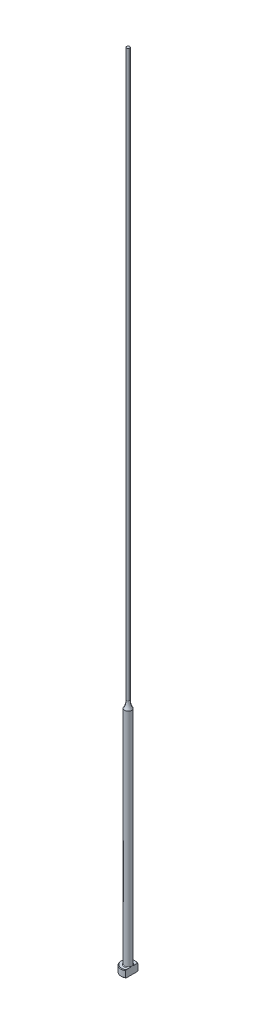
SolidWorks part; units mm, degrees
ref_plane "Front Plane" through (0, 0, 0) normal (0, 0, 1) x (1, 0, 0)
ref_plane "Top Plane" through (0, 0, 0) normal (0, 1, 0) x (1, 0, 0)
ref_plane "Right Plane" through (0, 0, 0) normal (1, 0, 0) x (0, 0, -1)
sketch "Sketch1" plane through (0, 0, 0) normal (0, 0, 1) x (1, 0, 0)
  line L0 (0, 259.9588) -> (0, -15.1925) construction
  line L1 (0, 0) -> (-3.175, 0)
  line L2 (-3.175, 0) -> (-3.175, 3.175)
  line L3 (-3.175, 3.175) -> (-1.5875, 3.175)
  line L4 (-0.6579, 104.9079) -> (-0.6579, 355.6)
  line L5 (-0.6579, 355.6) -> (0, 355.6)
  line L6 (0, 355.6) -> (0, 0)
  line L7 (-1.5875, 3.175) -> (-1.5875, 101.6)
  arc A0 (-1.5875, 101.6) -> (-0.6579, 104.9079) centre (-7.0079, 104.9079) ccw
  point P13 (-1.5875, 0)
  dimension "D1" = 6.35
  dimension "L" = 355.6
  dimension "D2" = 3.175
  dimension "H" = 6.35
  dimension "T" = 3.175
  dimension "D" = 1.3157
  dimension "S" = 101.6
revolve "Revolve1" add sketch "Sketch1" angle 360 about L0
chamfer "Chamfer1" distance 0.254 angle 45 2 edges at (0, 3.175, 3.175) (0, 0, 3.175)
fillet "Fillet1" radius 0.254 1 edges at (0, 3.175, 1.5875)
sketch "Sketch2" plane through (0, 0, 0) normal (0, 1, 0) x (1, 0, 0)
  line L0 (1.5875, -2.7496) -> (1.5875, 2.7496)
  circle A0 centre (0, 0) radius 3.175 construction
  arc A2 (1.5875, -2.7496) -> (1.5875, 2.7496) centre (0, 0) ccw
  circle A3 centre (0, 0) radius 3.175 construction
  circle A4 centre (0, 0) radius 1.5875 construction
extrude "Key Head" cut sketch "Sketch2" along normal up to next
